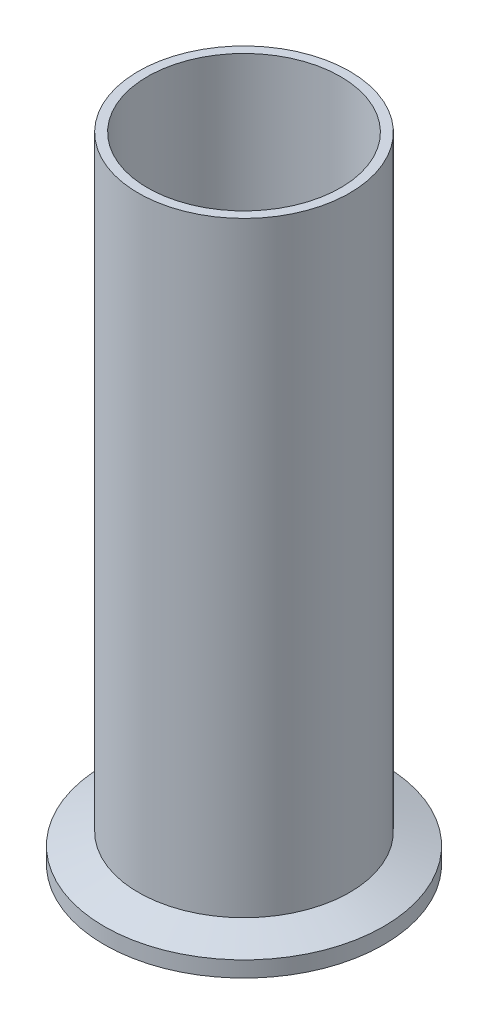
SolidWorks part; units mm, degrees
ref_plane "Front Plane" through (0, 0, 0) normal (0, 0, 1) x (1, 0, 0)
ref_plane "Top Plane" through (0, 0, 0) normal (0, 1, 0) x (1, 0, 0)
ref_plane "Right Plane" through (0, 0, 0) normal (1, 0, 0) x (0, 0, -1)
sketch "Sketch1" plane through (0, 0, 0) normal (0, 0, 1) x (1, 0, 0)
  line L0 (0, 0) -> (0, 114.3) construction
  line L1 (0, 114.3) -> (-19.05, 114.3)
  line L2 (-19.05, 114.3) -> (-19.05, 5.0821)
  line L3 (-19.05, 5.0821) -> (-25.1968, 2.8448)
  line L4 (-25.1968, 2.8448) -> (-25.1968, 0)
  line L5 (-25.1968, 0) -> (-23.6366, 0)
  line L6 (-20.0006, 0) -> (0, 0)
  line L7 (0, 0) -> (0, 114.3)
  line L8 (0, 114.3) -> (-17.399, 114.3)
  line L9 (-17.399, 114.3) -> (-17.399, 0)
  line L10 (-17.399, 0) -> (0, 0)
  line L11 (0, 0) -> (-0.1846, 0.0129)
  arc A0 (-22.9141, 0.4745) -> (-20.7231, 0.4745) centre (-21.8186, 0) cw
  arc A1 (-20.0006, 0) -> (-20.7231, 0.4745) centre (-20.0006, 0.7874) cw
  arc A2 (-22.9141, 0.4745) -> (-23.6366, 0) centre (-23.6366, 0.7874) cw
  point P12 (-20.6248, 0)
  dimension "D6" = 1.1938
  dimension "D7" = 0.7874
  dimension "D1" = 19.05
  dimension "D2" = 2.8448
  dimension "D3" = 25.1968
  dimension "D4" = 70
  dimension "D5" = 21.8186
  dimension "D8" = 1.651
  dimension "D9" = 114.3
revolve "Revolve2" add sketch "Sketch1" angle 360 about L0
